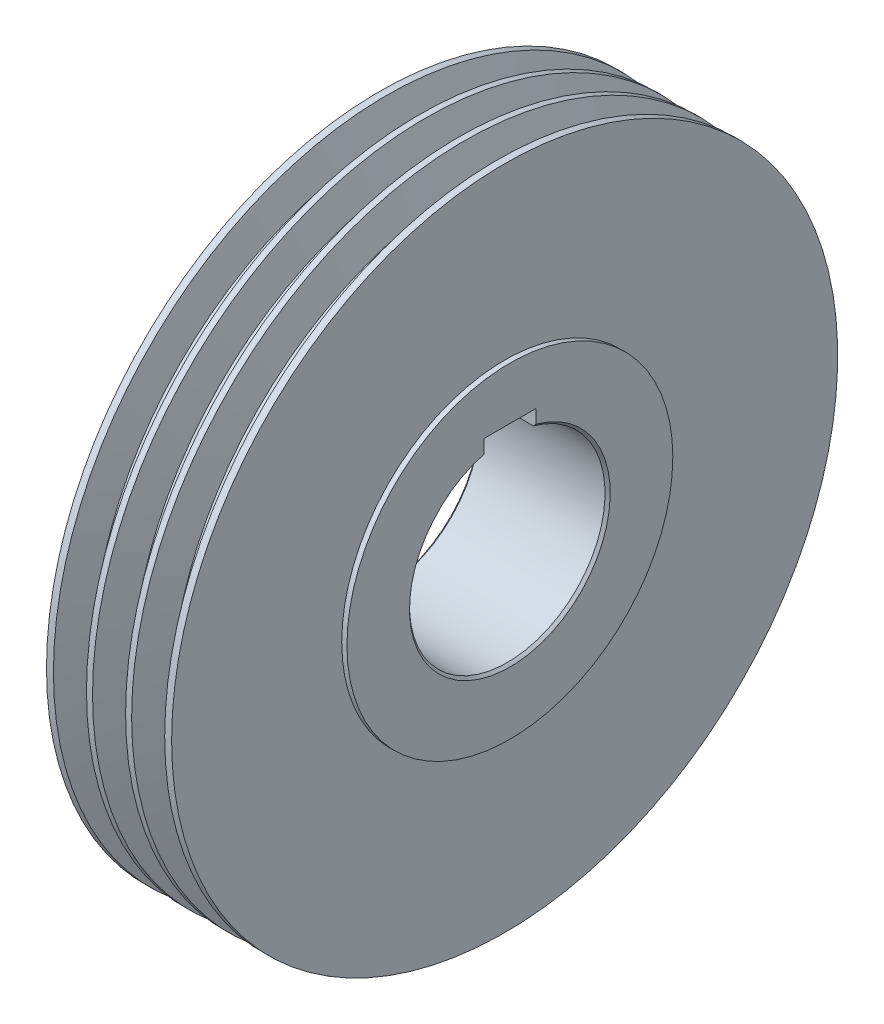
SolidWorks part; units mm, degrees
ref_plane "前视基准面" through (0, 0, 0) normal (0, 0, 1) x (1, 0, 0)
ref_plane "上视基准面" through (0, 0, 0) normal (0, 1, 0) x (1, 0, 0)
ref_plane "右视基准面" through (0, 0, 0) normal (1, 0, 0) x (0, 0, -1)
sketch "草图1" plane through (0, 0, 0) normal (0, 0, 1) x (1, 0, 0)
  line L0 (0, 0) -> (64.8368, 0) construction
  line L1 (0, 37.5) -> (0, 127.75)
  line L2 (0, 127.75) -> (48, 127.75)
  line L3 (48, 127.75) -> (48, 62.5)
  line L4 (48, 62.5) -> (50, 62.5)
  line L5 (50, 62.5) -> (50, 37.5)
  line L6 (50, 37.5) -> (0, 37.5)
  line L7 (2.6592, 127.75) -> (6.1599, 116.3) construction
  line L8 (6.1599, 116.3) -> (11.8401, 116.3) construction
  line L9 (11.8401, 116.3) -> (15.3408, 127.75) construction
  line L10 (0, 125) -> (48, 125) construction
  line L11 (9, 116.3) -> (9, 37.5) construction
  point P17 (3.5, 125)
  point P18 (14.5, 125)
  dimension "d2" = 255.5
  dimension "L" = 50
  dimension "B" = 48
  dimension "d" = 75
  dimension "d1" = 125
  dimension "dd" = 250
  dimension "f" = 9
  dimension "槽轮角" = 34
  dimension "bd" = 11
  dimension "hf" = 8.7
  dimension "ha" = 2.75
revolve "旋转1" add sketch "草图1" angle 360 about L0
sketch "草图2" plane through (0, 0, 0) normal (0, 0, 1) x (1, 0, 0)
  line L0 (11.8401, 116.3) -> (15.3408, 127.75) construction
  line L1 (6.1599, 116.3) -> (11.8401, 116.3) construction
  line L2 (2.6592, 127.75) -> (6.1599, 116.3) construction
  line L3 (11.8401, 116.3) -> (15.3408, 127.75)
  line L4 (6.1599, 116.3) -> (11.8401, 116.3)
  line L5 (2.6592, 127.75) -> (6.1599, 116.3)
  line L6 (2.6592, 127.75) -> (15.3408, 127.75)
  line L7 (0, 0) -> (48, 0) construction
  line L8 (48, -62.5) -> (48, 62.5) construction
revolve "切除-旋转1" cut sketch "草图2" angle 360 about L7
pattern_linear "阵列(线性)1" count 3 spacing 15 along (1, 0, 0) of "切除-旋转1"
chamfer "倒角1" distance 1 2 edges at (50, 0, 37.5) (0, 0, 37.5)
sketch "草图4" plane through (0, 0, 0) normal (-1, 0, 0) x (0, 0, 1)
  line L1 (-10, 36.1421) -> (10, 36.1421)
  line L2 (-10, 36.1421) -> (-10, 42.4)
  line L3 (-10, 42.4) -> (10, 42.4)
  line L4 (10, 36.1421) -> (10, 42.4)
  circle A0 centre (0, 0) radius 37.5 construction
  point P6 (5.1, 42.4)
  dimension "键槽高度" = 42.4
  dimension "键槽宽度" = 20
  dimension "t1" = 4.9
extrude "切除-拉伸1" cut sketch "草图4" against normal through all
equation "\"B@草图1\" =  ( \"z@阵列(线性)1\" - 1 )  * \"e@阵列(线性)1\" +2 *  \"f@草图1\""
equation "\"键槽高度@草图4\" = \"d@草图1\" / 2  + \"t1@草图4\""
